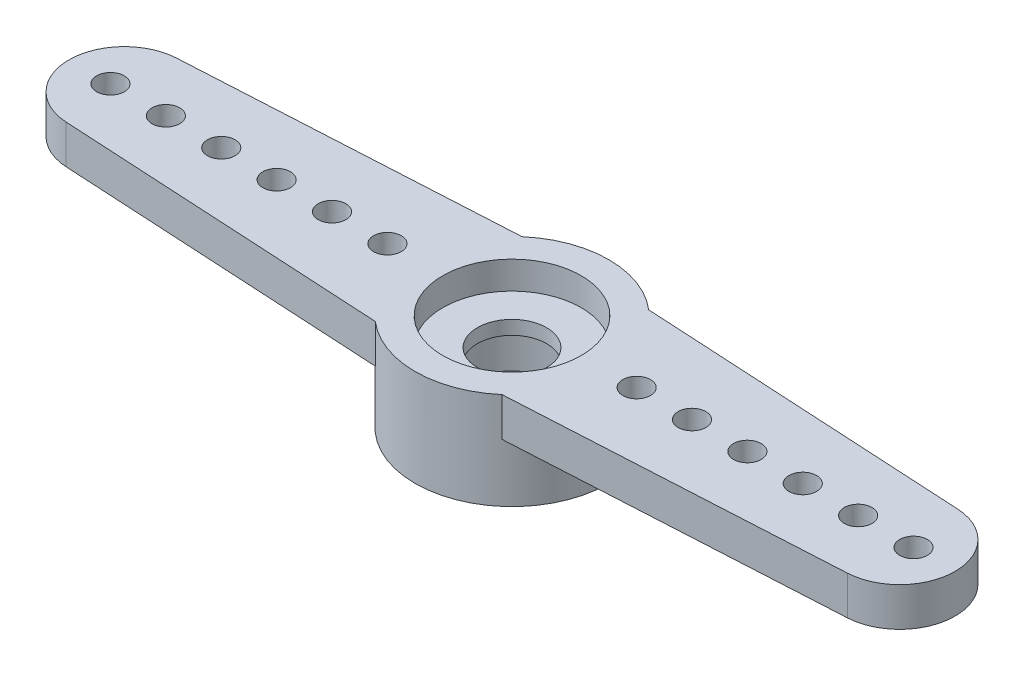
SolidWorks part; units mm, degrees
ref_plane "Přední rovina" through (0, 0, 0) normal (0, 0, 1) x (1, 0, 0)
ref_plane "Horní rovina" through (0, 0, 0) normal (0, 1, 0) x (1, 0, 0)
ref_plane "Pravá rovina" through (0, 0, 0) normal (1, 0, 0) x (0, 0, -1)
sketch "Skica1" plane through (0, 0, 0) normal (0, 1, 0) x (1, 0, 0)
  circle A0 centre (0, 0) radius 3.5
  dimension "D1" = 7
extrude "Vysunout1" add sketch "Skica1" against normal blind 3.5
sketch "Skica2" plane through (0, -3.5, 0) normal (0, -1, 0) x (1, 0, 0)
  circle A0 centre (0, 0) radius 2.5
  dimension "D1" = 5
extrude "Odebrat vysunutím1" cut sketch "Skica2" against normal blind 2
sketch "Skica4" plane through (0, 0, 0) normal (0, 1, 0) x (1, 0, 0)
  circle A0 centre (0, 0) radius 2.5
  dimension "D1" = 5
extrude "Odebrat vysunutím3" cut sketch "Skica4" against normal blind 1
sketch "Skica3" plane through (0, 0, 0) normal (0, 1, 0) x (-1, 0, 0)
  circle A0 centre (0, 0) radius 1.25
  dimension "D1" = 2.5
extrude "Odebrat vysunutím2" cut sketch "Skica3" against normal through all
sketch "Skica5" plane through (0, 0, 0) normal (0, 1, 0) x (1, 0, 0)
  line L0 (-17.6859, 0) -> (20.9438, 0) construction
  line L1 (0, 5.7754) -> (0, -6.537) construction
  line L2 (-14.1103, -1.997) -> (-2.2864, -2.65)
  line L3 (-14.1103, 1.997) -> (-2.2864, 2.65)
  line L4 (14.1103, 1.997) -> (2.2864, 2.65)
  line L5 (14.1103, -1.997) -> (2.2864, -2.65)
  arc A0 (-14.1103, -1.997) -> (-14.1103, 1.997) centre (-14, 0) cw
  circle A1 centre (0, 0) radius 3.5 construction
  arc A2 (14.1103, -1.997) -> (14.1103, 1.997) centre (14, 0) ccw
  arc A4 (-2.2864, 2.65) -> (-2.2864, -2.65) centre (0, 0) ccw
  arc A5 (2.2864, -2.65) -> (2.2864, 2.65) centre (0, 0) ccw
  dimension "D1" = 2
  dimension "D2" = 32
  dimension "D3" = 5.3
extrude "Přidat vysunutím1" add sketch "Skica5" against normal blind 1.4
sketch "Skica6" plane through (0, 0, 0) normal (0, 1, 0) x (1, 0, 0)
  line L0 (-17.0685, 0) -> (21.3231, 0) construction
  line L1 (0, 5.1306) -> (0, -9.0848) construction
  circle A0 centre (-14.5, 0) radius 0.5
  dimension "D1" = 29
  dimension "D2" = 1
extrude "Odebrat vysunutím4" cut sketch "Skica6" against normal through all
pattern_linear "LinPole1" count 6 spacing 2 along (1, 0, 0) of "Odebrat vysunutím4"
mirror "Zrcadlit1" about plane through (0, 0, 0) normal (1, 0, 0) of "LinPole1", "Odebrat vysunutím4"
